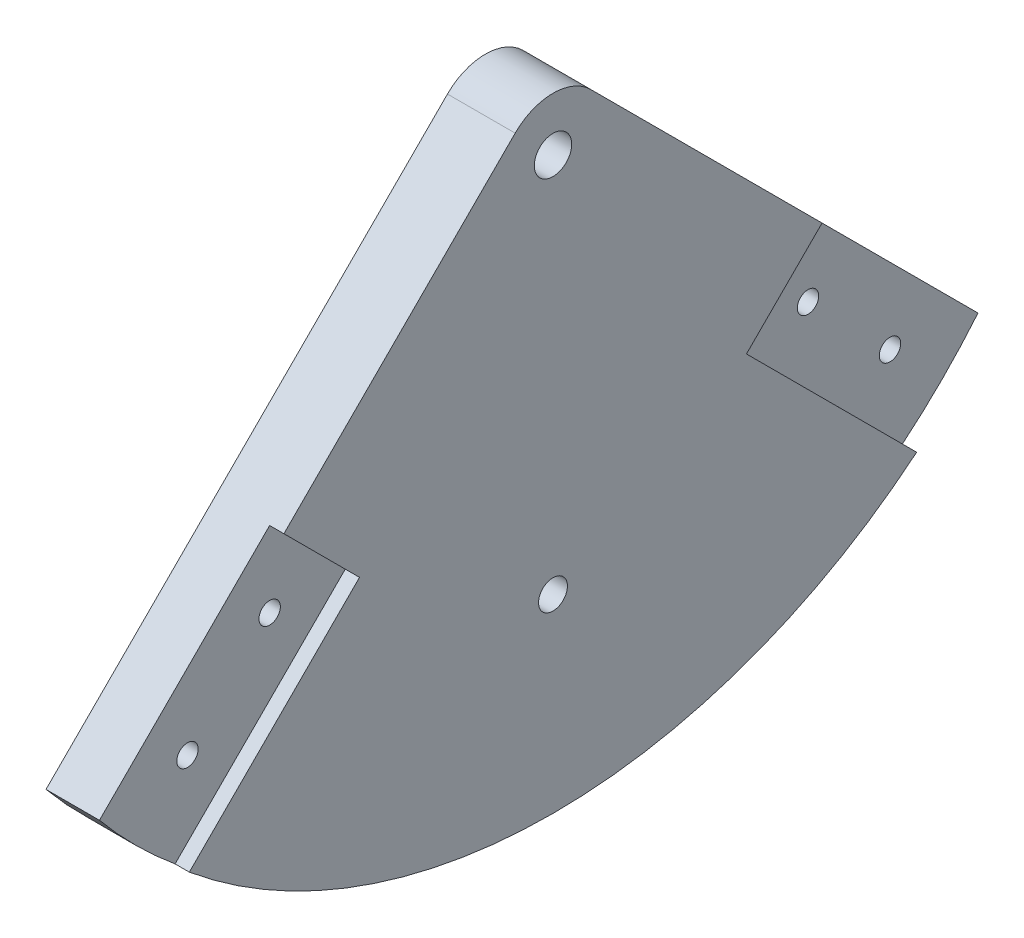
SolidWorks part; units mm, degrees
ref_plane "Piano frontale" through (0, 0, 0) normal (0, 0, 1) x (1, 0, 0)
ref_plane "Piano superiore" through (0, 0, 0) normal (0, 1, 0) x (1, 0, 0)
ref_plane "Piano destro" through (0, 0, 0) normal (1, 0, 0) x (0, 0, -1)
sketch "Schizzo1" plane through (0, 0, 0) normal (1, 0, 0) x (0, 0, -1)
  line L38 (-10.609, 10.6065) -> (-123.2495, -102.0334)
  line L225 (123.2482, -102.0322) -> (10.6066, 10.6066)
  circle A0 centre (0, -106.7679) radius 4.05
  circle A1 centre (0, 0) radius 5.25
  circle A2 centre (-75.497, -75.4955) radius 3
  circle A3 centre (75.55, -75.4955) radius 3
  arc A4 (-10.609, 10.6065) -> (10.6066, 10.6066) centre (-0.0011, -0.0014) cw
  arc A5 (-123.2495, -102.0334) -> (123.2482, -102.0322) centre (-0.0011, -0.0014) ccw
  circle A6 centre (-98.5531, -98.5517) radius 3
  circle A7 centre (98.5504, -98.5517) radius 3
  point P11 (-98.5531, -98.5517)
  point P15 (98.5504, -98.5517)
  dimension "D1" = 8.1
  dimension "D2" = 6
  dimension "D3" = 10.5
  dimension "D4" = 15.0018
  dimension "D5" = 160.0021
  dimension "D6" = 10.6066
  dimension "D7" = 75.55
  dimension "D8" = 123.2482
  dimension "D9" = 10.609
  dimension "D10" = 10.6066
  dimension "D11" = 75.497
  dimension "D14" = 75.4955
  dimension "D17" = 106.7679
sketch "Schizzo4" plane through (0, 0, 0) normal (1, 0, 0) x (0, 0, -1)
  line L0 (102.0341, -123.247) -> (54.2831, -75.4963)
  line L1 (54.2831, -75.4963) -> (75.4971, -54.2823)
  line L2 (-75.4976, -54.2818) -> (-123.2495, -102.0334)
  line L3 (123.2482, -102.0322) -> (75.4971, -54.2823)
  line L4 (-10.609, 10.6065) -> (-123.2495, -102.0334) construction
  line L36 (-75.4976, -54.2818) -> (-54.2831, -75.4963)
  line L37 (-54.2831, -75.4963) -> (-102.0333, -123.2496)
  arc A0 (-123.2495, -102.0334) -> (-102.0333, -123.2496) centre (-0.0011, -0.0014) ccw
  arc A1 (102.0341, -123.247) -> (123.2482, -102.0322) centre (-0.0011, -0.0014) ccw
extrude "Estrusione-Estrusione2" add sketch "Schizzo1" against normal blind 19
extrude "Taglio-Estrusione2" cut sketch "Schizzo4" against normal blind 4
